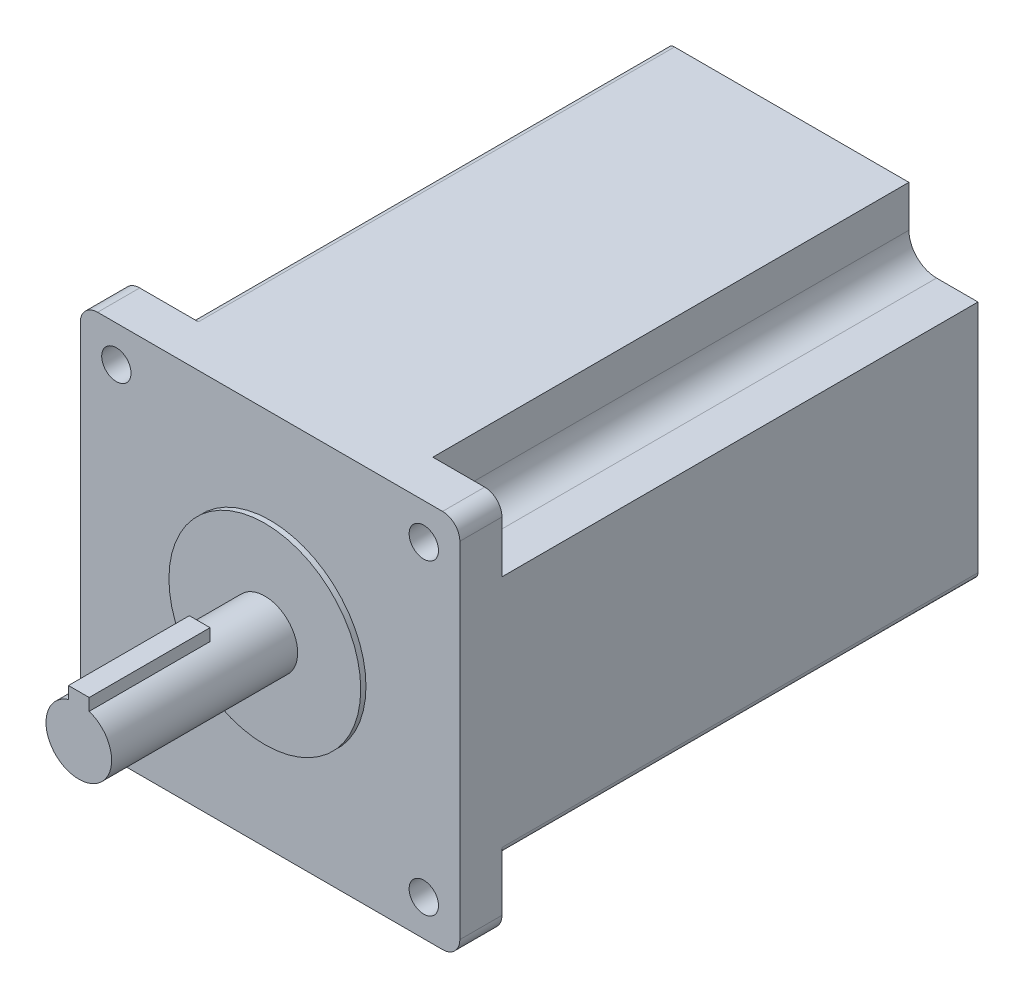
SolidWorks part; units mm, degrees
ref_plane "前视基准面" through (0, 0, 0) normal (0, 0, 1) x (1, 0, 0)
ref_plane "上视基准面" through (0, 0, 0) normal (0, 1, 0) x (1, 0, 0)
ref_plane "右视基准面" through (0, 0, 0) normal (1, 0, 0) x (0, 0, -1)
sketch "草图1" plane through (0, 0, 0) normal (0, 0, 1) x (1, 0, 0)
  line L1 (-25.903, 21.8902) -> (83.957, 21.8902)
  line L2 (-25.903, 21.8902) -> (-25.903, -87.9698)
  line L3 (-25.903, -87.9698) -> (83.957, -87.9698)
  line L4 (83.957, 21.8902) -> (83.957, -87.9698)
  dimension "D1" = 109.86
  dimension "D2" = 109.86
extrude "拉伸1" add sketch "草图1" along normal blind 150
sketch "草图2" plane through (0, 0, 0) normal (0, 0, -1) x (-1, 0, 0)
  line L1 (-83.957, 21.8902) -> (-63.957, 21.8902)
  line L2 (-83.957, 21.8902) -> (-83.957, 1.8902)
  line L3 (-83.957, 1.8902) -> (-63.957, 1.8902)
  line L4 (-63.957, 21.8902) -> (-63.957, 1.8902)
  line L5 (25.903, 21.8902) -> (5.903, 21.8902)
  line L6 (25.903, 21.8902) -> (25.903, 1.8902)
  line L7 (25.903, 1.8902) -> (5.903, 1.8902)
  line L8 (5.903, 21.8902) -> (5.903, 1.8902)
  line L10 (25.903, -87.9698) -> (5.903, -87.9698)
  line L11 (25.903, -87.9698) -> (25.903, -67.9698)
  line L12 (25.903, -67.9698) -> (5.903, -67.9698)
  line L13 (5.903, -87.9698) -> (5.903, -67.9698)
  line L14 (-83.957, -87.9698) -> (-63.957, -87.9698)
  line L15 (-83.957, -87.9698) -> (-83.957, -67.9698)
  line L16 (-83.957, -67.9698) -> (-63.957, -67.9698)
  line L17 (-63.957, -87.9698) -> (-63.957, -67.9698)
  dimension "D1" = 20
  dimension "D2" = 20
  dimension "D3" = 20
  dimension "D4" = 20
  dimension "D5" = 20
  dimension "D6" = 20
  dimension "D7" = 20
  dimension "D8" = 20
extrude "拉伸2" cut sketch "草图2" against normal blind 137.81
sketch "草图5" plane through (0, 0, 150) normal (0, 0, 1) x (1, 0, 0)
  line L0 (-25.903, 21.8902) -> (83.957, -87.9698) construction
  circle A0 centre (29.027, -33.0398) radius 27.76
  dimension "D1" = 55.52
extrude "拉伸3" add sketch "草图5" along normal blind 1.52
sketch "草图6" plane through (0, 0, 151.52) normal (0, 0, 1) x (1, 0, 0)
  circle A0 centre (29.027, -33.0398) radius 9.5
  dimension "D1" = 19
extrude "拉伸4" add sketch "草图6" along normal blind 53.85
sketch "草图7" plane through (0, 0, 205.37) normal (0, 0, 1) x (1, 0, 0)
  line L0 (29.027, -33.0398) -> (29.027, -16.1977) construction
  line L1 (29.027, -20.5398) -> (29.027, -26.5398) construction
  line L2 (26.027, -20.5398) -> (32.027, -20.5398)
  line L3 (26.027, -20.5398) -> (26.027, -26.5398)
  line L4 (26.027, -26.5398) -> (32.027, -26.5398)
  line L5 (32.027, -20.5398) -> (32.027, -26.5398)
  circle A0 centre (29.027, -33.0398) radius 9.5 construction
  dimension "D1" = 6
  dimension "D2" = 6
  dimension "D3" = 12.5
extrude "拉伸5" add sketch "草图7" against normal blind 35
fillet "圆角1" radius 5 4 edges at (83.957, 21.8902, 143.905) (-25.903, 21.8902, 143.905) (-25.903, -87.9698, 143.905) (83.957, -87.9698, 143.905)
fillet "圆角2" radius 2 6 edges at (-5.903, 21.8902, 68.905) (83.957, -67.9698, 68.905) (63.957, -87.9698, 68.905) (-5.903, -87.9698, 68.905) (-25.903, -67.9698, 68.905) (-25.903, 1.8902, 68.905)
fillet "圆角3" radius 8 4 edges at (-5.903, -67.9698, 68.905) (63.957, 1.8902, 68.905) (-5.903, 1.8902, 68.905) (63.957, -67.9698, 68.905)
sketch "草图8" plane through (0, 0, 150) normal (0, 0, 1) x (1, 0, 0)
  line L0 (-24.4386, 20.4257) -> (82.4925, -86.5053) construction
  line L1 (-24.4386, -86.5053) -> (82.4925, 20.4257) construction
  circle A0 centre (29.027, -33.0398) radius 62.9325 construction
  arc A1 (-20.903, 21.8902) -> (-25.903, 16.8902) centre (-20.903, 16.8902) ccw construction
  arc A2 (78.957, -87.9698) -> (83.957, -82.9698) centre (78.957, -82.9698) ccw construction
  arc A3 (-25.903, -82.9698) -> (-20.903, -87.9698) centre (-20.903, -82.9698) ccw construction
  arc A4 (83.957, 16.8902) -> (78.957, 21.8902) centre (78.957, 16.8902) ccw construction
  circle A5 centre (-15.473, 11.4602) radius 4.25
  circle A6 centre (73.527, 11.4602) radius 4.25
  circle A7 centre (-15.473, -77.5398) radius 4.25
  circle A8 centre (73.527, -77.5398) radius 4.25
  dimension "D1" = 8.5
  dimension "D2" = 8.5
  dimension "D3" = 89
  dimension "D4" = 8.5
  dimension "D5" = 8.5
extrude "拉伸6" cut sketch "草图8" against normal through all
